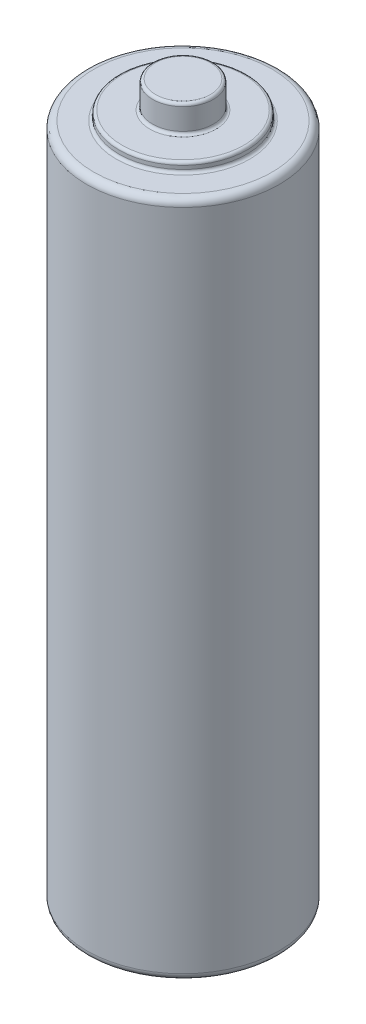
SolidWorks part; units mm, degrees
ref_plane "Plan de face" through (0, 0, 0) normal (0, 0, 1) x (1, 0, 0)
ref_plane "Plan de dessus" through (0, 0, 0) normal (0, 1, 0) x (1, 0, 0)
ref_plane "Plan de droite" through (0, 0, 0) normal (1, 0, 0) x (0, 0, -1)
sketch "Esquisse1" plane through (0, 0, 0) normal (0, 1, 0) x (1, 0, 0)
  circle A0 centre (0, 0) radius 6.75
  dimension "D1" = 13.5
extrude "Extrusion1" add sketch "Esquisse1" along normal blind 47.5
sketch "Esquisse2" plane through (0, 47.5, 0) normal (0, 1, 0) x (-1, 0, 0)
  circle A0 centre (0, 0) radius 4.475
  dimension "D1" = 8.95
extrude "Extrusion2" add sketch "Esquisse2" along normal blind 0.65
sketch "Esquisse3" plane through (0, 48.15, 0) normal (0, 1, 0) x (-1, 0, 0)
  circle A0 centre (0, 0) radius 2.125
  dimension "D1" = 4.25
extrude "Extrusion3" add sketch "Esquisse3" along normal blind 1.9
fillet "Congé2" radius 0.2 1 edges at (0, 50.05, 2.125)
fillet "Congé3" radius 0.2 1 edges at (0, 48.15, 2.125)
fillet "Congé4" radius 0.2 2 edges at (0, 47.5, 4.475) (0, 48.15, 4.475)
sketch "Esquisse4" plane through (0, 0, 0) normal (0, -1, 0) x (1, 0, 0)
  circle A0 centre (0, 0) radius 5
  dimension "D1" = 10
extrude "Extrusion4" add sketch "Esquisse4" along normal blind 0.1
sketch "Esquisse5" plane through (0, -0.1, 0) normal (0, -1, 0) x (1, 0, 0)
  circle A0 centre (0, 0) radius 2
  dimension "D1" = 4
extrude "Enlèv. mat.-Extru.1" cut sketch "Esquisse5" against normal blind 0.1
fillet "Congé6" radius 0.05 3 edges at (0, -0.1, -2) (0, 0, -2) (0, -0.1, -5)
fillet "Congé7" radius 0.5 2 edges at (0, 0, 6.75) (0, 47.5, 6.75)
